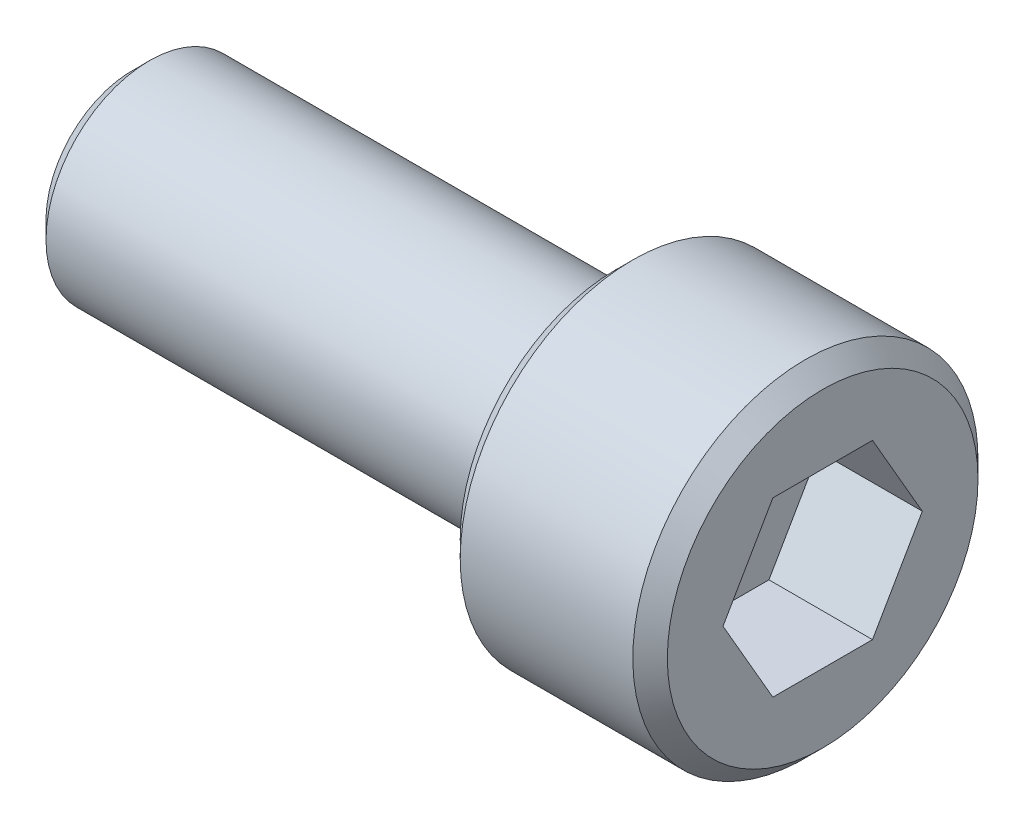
SolidWorks part; units mm, degrees
ref_plane "Plan de face" through (0, 0, 0) normal (0, 0, 1) x (1, 0, 0)
ref_plane "Plan de dessus" through (0, 0, 0) normal (0, 1, 0) x (1, 0, 0)
ref_plane "Plan de droite" through (0, 0, 0) normal (1, 0, 0) x (0, 0, -1)
sketch "Esquisse1" plane through (0, 0, 0) normal (0, 0, 1) x (1, 0, 0)
  line L0 (0, 0) -> (-20, 0) construction
  line L1 (-20, 0) -> (-20, 3)
  line L2 (-20, 3) -> (-6, 3)
  line L3 (-6, 3) -> (-6, 5)
  line L4 (-6, 5) -> (0, 5)
  line L5 (0, 5) -> (0, 0)
  line L6 (0, 0) -> (-20, 0)
  dimension "D1" = 6
  dimension "D2" = 14
  dimension "D3" = 6
  dimension "D4" = 10
revolve "Révolution1" add sketch "Esquisse1" angle 360 about L0
sketch "Esquisse2" plane through (0, 0, 0) normal (1, 0, 0) x (0, 0, -1)
  line L1 (2.8868, 0) -> (1.4434, 2.5)
  line L2 (1.4434, 2.5) -> (-1.4434, 2.5)
  line L3 (-1.4434, 2.5) -> (-2.8868, 0)
  line L4 (-2.8868, 0) -> (-1.4434, -2.5)
  line L5 (-1.4434, -2.5) -> (1.4434, -2.5)
  line L6 (1.4434, -2.5) -> (2.8868, 0)
  circle A0 centre (0, 0) radius 2.5 construction
  dimension "D1" = 5
extrude "Enlèv. mat.-Extru.1" cut sketch "Esquisse2" against normal blind 3
chamfer "Chanfrein2" distance 0.5 angle 45 3 edges at (0, 5, 0) (-6, 5, 0) (-20, 3, 0)
